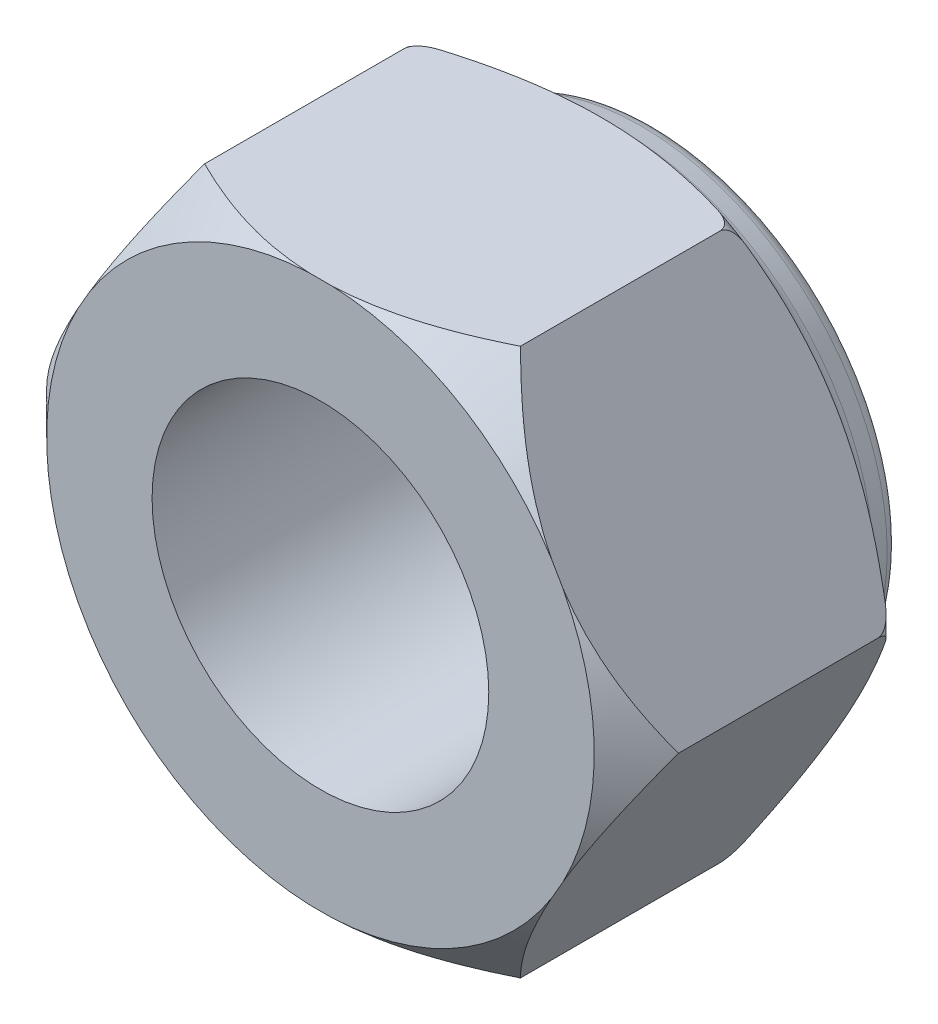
SolidWorks part; units mm, degrees
ref_plane "Plan de face" through (0, 0, 0) normal (0, 0, 1) x (1, 0, 0)
ref_plane "Plan de dessus" through (0, 0, 0) normal (0, 1, 0) x (1, 0, 0)
ref_plane "Plan de droite" through (0, 0, 0) normal (1, 0, 0) x (0, 0, -1)
sketch "Esquisse1" plane through (0, 0, 0) normal (0, 0, 1) x (1, 0, 0)
  line L1 (7.5056, 0) -> (3.7528, 6.5)
  line L2 (3.7528, 6.5) -> (-3.7528, 6.5)
  line L3 (-3.7528, 6.5) -> (-7.5056, 0)
  line L4 (-7.5056, 0) -> (-3.7528, -6.5)
  line L5 (-3.7528, -6.5) -> (3.7528, -6.5)
  line L6 (3.7528, -6.5) -> (7.5056, 0)
  circle A0 centre (0, 0) radius 6.5 construction
  dimension "D1" = 13
extrude "Boss.-Extru.1" add sketch "Esquisse1" along normal blind 8
sketch "Esquisse2" plane through (0, 0, 8) normal (0, 0, 1) x (1, 0, 0)
  circle A0 centre (0, 0) radius 4
  dimension "D1" = 8
extrude "Enlèv. mat.-Extru.1" cut sketch "Esquisse2" against normal blind 10.8
sketch "Esquisse4" plane through (0, 0, 0) normal (0, 1, 0) x (1, 0, 0)
  line L0 (-7.5056, -7) -> (-6.5056, -8)
  line L1 (-7.5056, -7) -> (-9.8592, -7)
  line L2 (-7.5056, -8) -> (-7.5056, 0) construction
  line L3 (-5.8447, -0.3787) -> (-5.953, -0.812)
  line L4 (-3.7528, -8) -> (-7.5056, -8) construction
  line L5 (-9.8592, -7) -> (-9.8592, -13.5545)
  line L6 (-9.8592, -13.5545) -> (-6.5056, -13.5545)
  line L7 (-6.5056, -13.5545) -> (-6.5056, -8)
  line L8 (-3.7528, 0) -> (-7.5056, 0) construction
  line L9 (-6.1614, -1.1072) -> (-7.2822, -1.8516)
  line L10 (-7.5056, -2.2681) -> (-7.5056, -2.9859)
  line L11 (-7.5056, -2.9859) -> (-9.8592, -2.9859)
  line L12 (-9.8592, -2.9859) -> (-9.8592, 0.7796)
  line L13 (-9.8592, 0.7796) -> (-4.8559, 0.7796)
  line L14 (-4.8559, 0.7796) -> (-5, 0.7796)
  line L15 (-5, 0.7796) -> (-5, 0)
  line L16 (-5, 0) -> (-5.3596, 0)
  line L17 (0, 0.3996) -> (0, -12.6586) construction
  arc A0 (-7.2822, -1.8516) -> (-7.5056, -2.2681) centre (-7.0056, -2.2681) ccw
  arc A1 (-5.953, -0.812) -> (-6.1614, -1.1072) centre (-6.4381, -0.6907) cw
  arc A2 (-5.8447, -0.3787) -> (-5.3596, 0) centre (-5.3596, -0.5) cw
  point P24 (-7.5056, -2)
  point P27 (-6, -1)
  point P30 (-5.75, 0)
  dimension "D8" = 0.5
  dimension "D1" = 1
  dimension "D2" = 1
  dimension "D3" = 5
  dimension "D4" = 5.75
  dimension "D5" = 6
  dimension "D6" = 1
  dimension "D7" = 1
revolve "Enlèvement de matière-Révolution3" cut sketch "Esquisse4" angle 360 about L17
